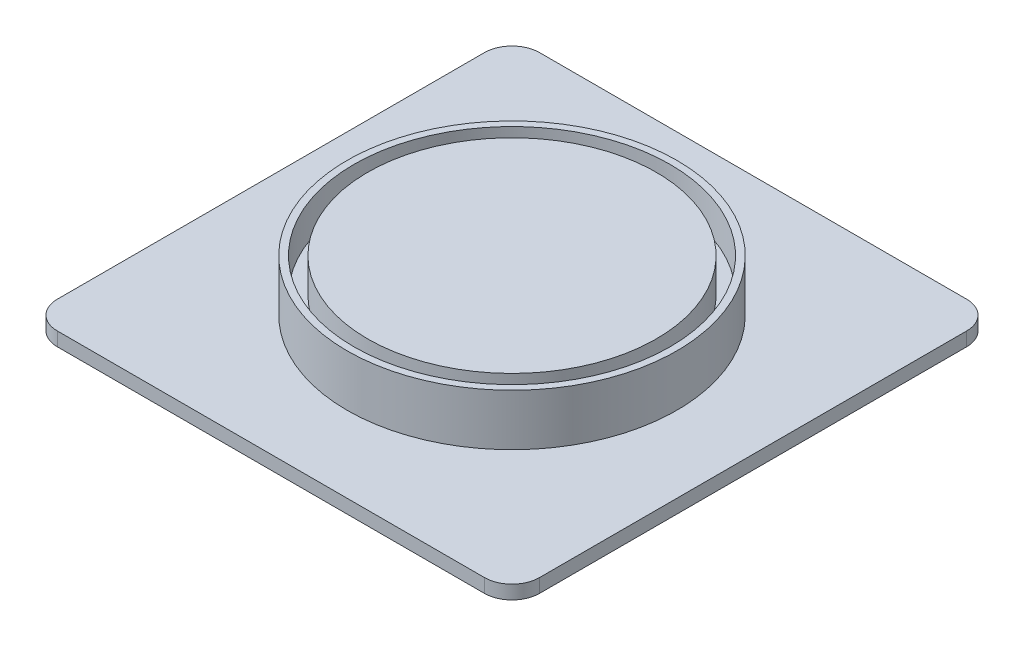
SolidWorks part; units mm, degrees
ref_plane "Front Plane" through (0, 0, 0) normal (0, 0, 1) x (1, 0, 0)
ref_plane "Top Plane" through (0, 0, 0) normal (0, 1, 0) x (1, 0, 0)
ref_plane "Right Plane" through (0, 0, 0) normal (1, 0, 0) x (0, 0, -1)
sketch "Sketch1" plane through (0, 0, 0) normal (0, 1, 0) x (1, 0, 0)
  circle A0 centre (0, 0) radius 120
  dimension "D1" = 240
extrude "Extrude1" add sketch "Sketch1" along normal blind 37.4682
sketch "Sketch2" plane through (0, 0, 0) normal (0, 1, 0) x (1, 0, 0)
  line L1 (-175.4, -175.4) -> (175.4, -175.4)
  line L2 (-175.4, -175.4) -> (-175.4, 175.4)
  line L3 (-175.4, 175.4) -> (175.4, 175.4)
  line L4 (175.4, -175.4) -> (175.4, 175.4)
  line L5 (-175.4, -175.4) -> (175.4, 175.4) construction
  line L6 (-175.4, 175.4) -> (175.4, -175.4) construction
  point P0 (0, 0)
  dimension "D1" = 350.8
extrude "Extrude2" add sketch "Sketch2" against normal blind 10
fillet "Fillet1" radius 20 4 edges at (175.4, -5, 175.4) (175.4, -5, -175.4) (-175.4, -5, -175.4) (-175.4, -5, 175.4)
sketch "Sketch3" plane through (0, 37.4682, 0) normal (0, 1, 0) x (1, 0, 0)
  circle A2 centre (0, 0) radius 115
  circle A3 centre (0, 0) radius 115
  circle A5 centre (0, 0) radius 105
  circle A6 centre (0, 0) radius 105
  dimension "D1" = 5
  dimension "D2" = 15
extrude "Extrude3" cut sketch "Sketch3" against normal blind 25
